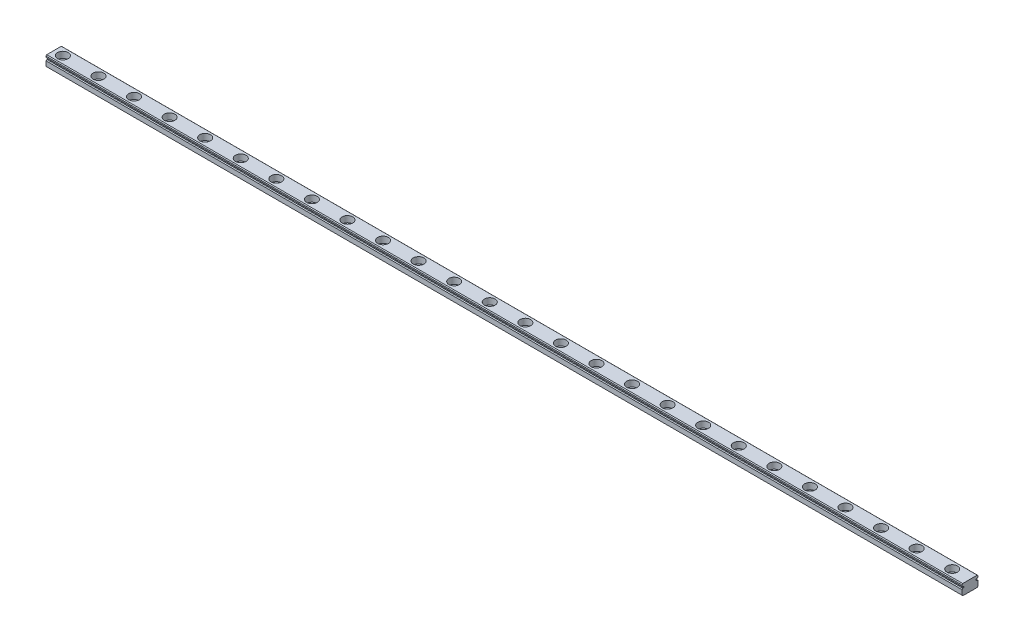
SolidWorks part; units mm, degrees
ref_plane "Front Plane" through (0, 0, 0) normal (0, 0, 1) x (1, 0, 0)
ref_plane "Top Plane" through (0, 0, 0) normal (0, 1, 0) x (1, 0, 0)
ref_plane "Right Plane" through (0, 0, 0) normal (1, 0, 0) x (0, 0, -1)
ref_plane "Plane1" through (50, 0, 0) normal (1, 0, 0) x (0, 0, -1)
sketch "Sketch1" plane through (50, 0, 0) normal (1, 0, 0) x (0, 0, -1)
  line L0 (-4.5, 5.5) -> (-4.5, 0)
  line L1 (-4.5, 0) -> (4.5, 0)
  line L2 (4.5, 0) -> (4.5, 5.5)
  line L3 (4.1, 6) -> (-4.1, 6)
  arc A0 (4.5, 5.5) -> (4.1, 6) centre (3.5602, 5.1582) ccw
  arc A1 (-4.1, 6) -> (-4.5, 5.5) centre (-3.5602, 5.1582) ccw
extrude "Boss-Extrude1" add sketch "Sketch1" against normal blind 515
sketch "Sketch2" plane through (-465, 0, 0) normal (-1, 0, 0) x (0, 0, 1)
  line L0 (4.5, 3.2244) -> (4.5, 4.7756)
  arc A0 (4.5, 4.7756) -> (4.5, 3.2244) centre (4.65, 4) ccw
extrude "Cut-Extrude1" cut sketch "Sketch2" against normal through all
sketch "Sketch3" plane through (-465, 0, 0) normal (-1, 0, 0) x (0, 0, 1)
  line L0 (3.9688, 4.4) -> (3.52, 4.32)
  line L1 (3.4, 4.1744) -> (3.4, 3.8256)
  line L2 (3.52, 3.68) -> (3.9688, 3.6)
  arc A0 (3.9688, 3.6) -> (3.9688, 4.4) centre (4.65, 4) cw
  arc A1 (3.52, 4.32) -> (3.4, 4.1744) centre (3.76, 4) ccw
  arc A2 (3.4, 3.8256) -> (3.52, 3.68) centre (3.76, 4) ccw
extrude "Cut-Extrude2" cut sketch "Sketch3" against normal through all
sketch "Sketch4" plane through (-465, 0, 0) normal (-1, 0, 0) x (0, 0, 1)
  line L0 (-2.9, 0) -> (-2.1, 0)
  arc A0 (-2.1, 0) -> (-2.9, 0) centre (-2.5, -0.3) ccw
extrude "Cut-Extrude3" cut sketch "Sketch4" against normal blind 60
sketch "Sketch5" plane through (-465, 0, 0) normal (-1, 0, 0) x (0, 0, 1)
  line L0 (-4.5, 4.7756) -> (-4.5, 3.2244)
  arc A0 (-4.5, 3.2244) -> (-4.5, 4.7756) centre (-4.65, 4) ccw
extrude "Cut-Extrude4" cut sketch "Sketch5" against normal through all
sketch "Sketch6" plane through (-465, 0, 0) normal (-1, 0, 0) x (0, 0, 1)
  line L0 (-3.9688, 3.6) -> (-3.52, 3.68)
  line L1 (-3.4, 3.8256) -> (-3.4, 4.1744)
  line L2 (-3.52, 4.32) -> (-3.9688, 4.4)
  arc A0 (-3.9688, 4.4) -> (-3.9688, 3.6) centre (-4.65, 4) cw
  arc A1 (-3.52, 3.68) -> (-3.4, 3.8256) centre (-3.76, 4) ccw
  arc A2 (-3.4, 4.1744) -> (-3.52, 4.32) centre (-3.76, 4) ccw
extrude "Cut-Extrude5" cut sketch "Sketch6" against normal through all
hole_wizard "CBORE for M3 Hex Head Machine Screw1" positions "Sketch8" profile "Sketch7" counterbore size "M3" standard "ANSI Metric"
sketch "Sketch8" plane through (0, 6, 0) normal (0, 1, 0) x (1, 0, 0)
  point P0 (20, 0)
  point P1 (40, 0)
  point P2 (0, 0)
sketch "Sketch7" plane through (20, 6, 0) normal (1, 0, 0) x (0, 0, 1)
  line L0 (0, 0) -> (0, 6)
  line L1 (0, 6) -> (1.75, 6)
  line L3 (1.75, 6) -> (1.75, 3.5)
  line L4 (1.75, 3.5) -> (3, 3.5)
  line L5 (3, 3.5) -> (3, 0)
  line L7 (3, 0) -> (0, 0)
  line L11 (0, -6.35) -> (0, 107.95) construction
  dimension "Thru Hole Dia." = 3.5
  dimension "Thru Hole Depth" = 6
  dimension "C'Bore Dia." = 6
  dimension "C'Bore Depth" = 3.5
chamfer "Chamfer1" distance 0.2 angle 45 3 edges at (40, 0, 1.75) (20, 0, 1.75) (0, 0, 1.75)
chamfer "Chamfer2" distance 0.5 angle 45 2 edges at (-207.5, 0, -4.5) (-207.5, 0, 4.5)
pattern_linear "LPattern1" count 9 spacing 60 along (-1, 0, 0) of "CBORE for M3 Hex Head Machine Screw1"
